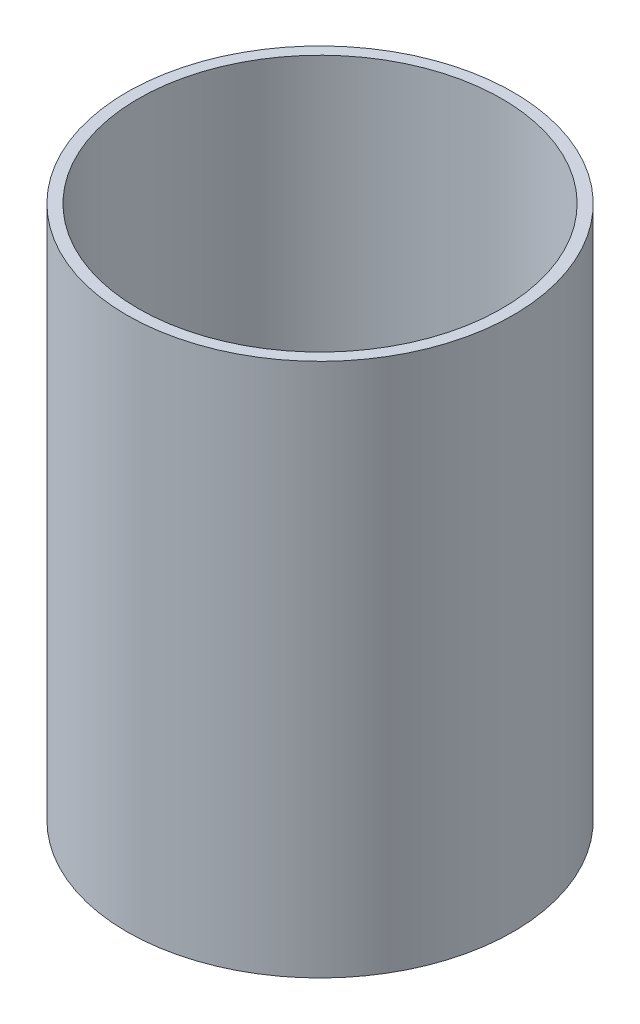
SolidWorks part; units mm, degrees
ref_plane "Front Plane" through (0, 0, 0) normal (0, 0, 1) x (1, 0, 0)
ref_plane "Top Plane" through (0, 0, 0) normal (0, 1, 0) x (1, 0, 0)
ref_plane "Right Plane" through (0, 0, 0) normal (1, 0, 0) x (0, 0, -1)
sketch "Sketch2" plane through (0, 0, 0) normal (0, 1, 0) x (1, 0, 0)
  circle A0 centre (0, 0) radius 101.6
  circle A1 centre (0, 0) radius 107.95
  dimension "D1" = 215.9
  dimension "D2" = 6.35
extrude "Boss-Extrude1" add sketch "Sketch2" along normal blind 298.45
